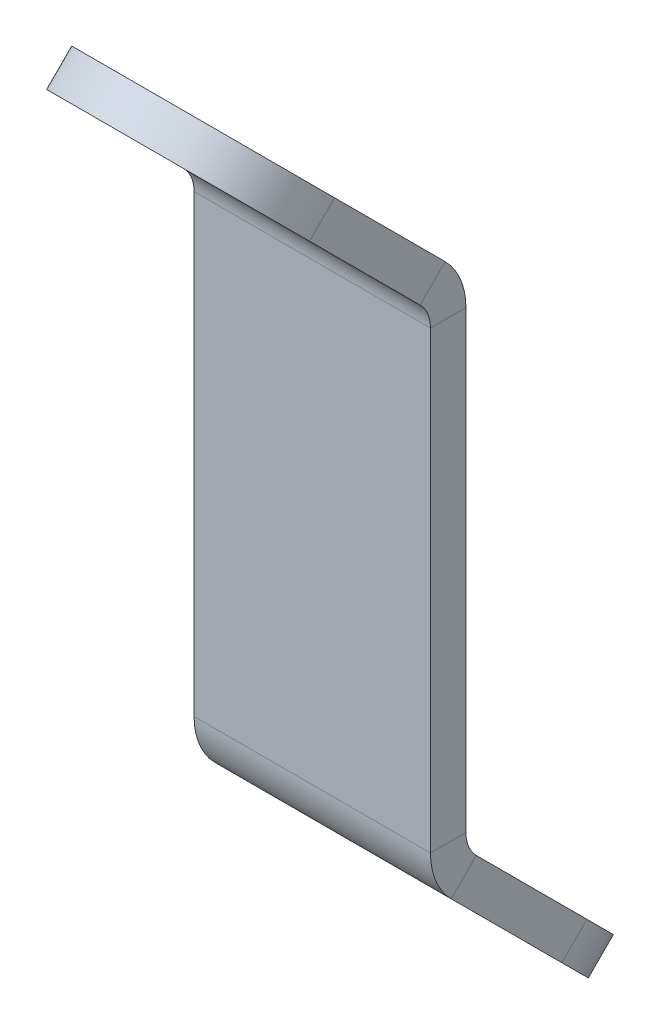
SolidWorks part; units mm, degrees
ref_plane "Plan1" through (0, 0, 0) normal (0, 0, 1) x (1, 0, 0)
ref_plane "Plan2" through (0, 0, 0) normal (0, 1, 0) x (1, 0, 0)
ref_plane "Plan3" through (0, 0, 0) normal (1, 0, 0) x (0, 0, -1)
sketch "Esquisse1" plane through (0, 0, 0) normal (0, 0, 1) x (1, 0, 0)
  line L0 (10, 72) -> (10, 0)
  line L1 (-10, 72) -> (-10, 0)
  circle A0 centre (0, 72) radius 4.25
  arc A1 (10, 72) -> (-10, 72) centre (0, 72) ccw
  arc A2 (-10, 0) -> (10, 0) centre (0, 0) ccw
  circle A4 centre (0, 0) radius 4.25
  dimension "D2" = 8.5
  dimension "D1" = 20
  dimension "D3" = 72
extrude "Base-Extrusion" add sketch "Esquisse1" along normal blind 3
sheet metal parameters "Tôlerie 1" parameters "D1"=3, "Epaisseur"=3
flatten bends "Dépliage 1" parameters "D1"=0
sketch "Esquisse-Angle1" plane through (0, 0, 3) normal (0, 0, 1) x (1, 0, 0)
process bends "Pliage 1" parameters "D1"=0
sketch "Esquisse-Plate1" plane through (0, 0, 3) normal (0, 0, 1) x (1, 0, 0)
  line L1 (-10, 57) -> (10, 57) construction
  line L2 (-10, 72) -> (-10, 0) construction
  line L6 (10, 72) -> (10, 0) construction
  line L7 (-10, 15) -> (10, 15) construction
  point P0 (0, 19)
  dimension "D1" = 15
  dimension "D2" = 15
bend "Pli défini à plat1" bend radius 3 bend angle 45 parameters "D5"=1
bend "Pli défini à plat2" bend radius 3 bend angle 45 parameters "D5"=2
